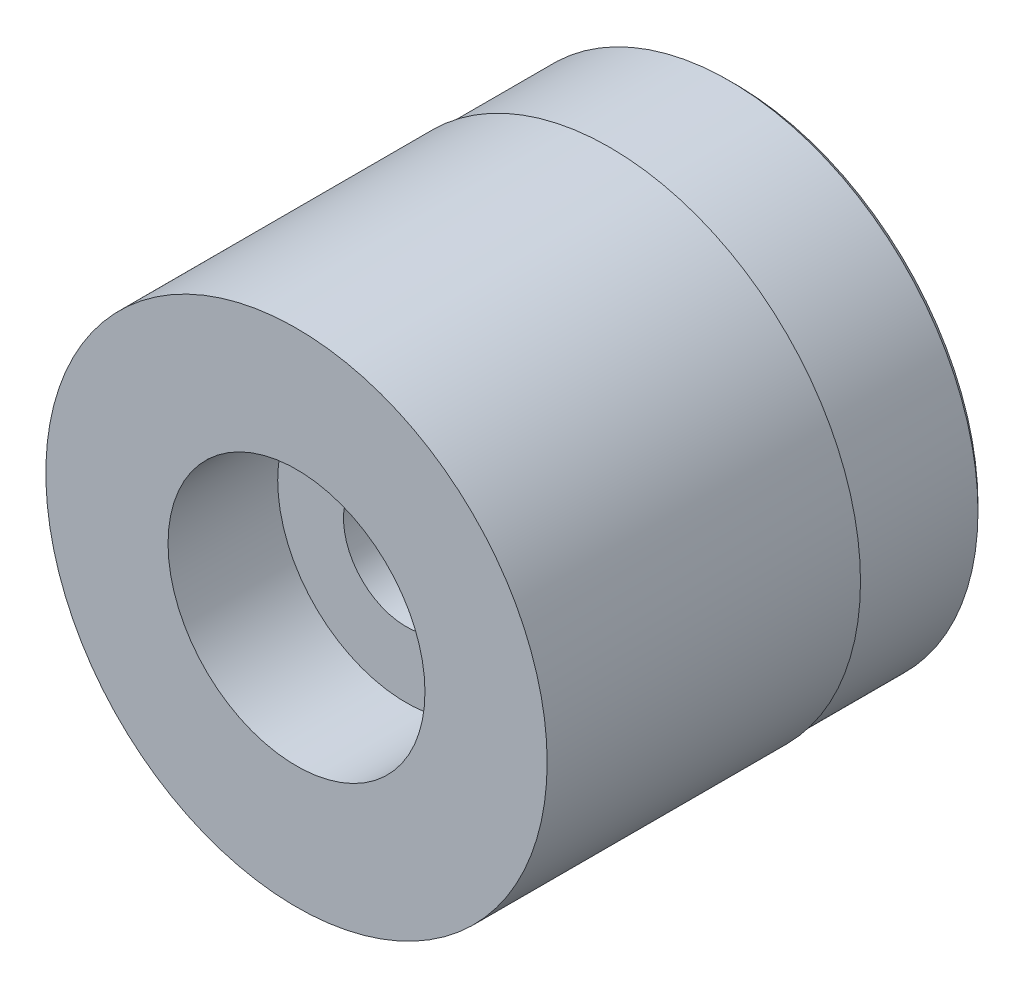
SolidWorks part; units mm, degrees
ref_plane "Front Plane" through (0, 0, 0) normal (0, 0, 1) x (1, 0, 0)
ref_plane "Top Plane" through (0, 0, 0) normal (0, 1, 0) x (1, 0, 0)
ref_plane "Right Plane" through (0, 0, 0) normal (1, 0, 0) x (0, 0, -1)
sketch "Sketch1" plane through (0, 0, 0) normal (1, 0, 0) x (0, 0, -1)
  line L2 (0, 8) -> (0, 4.1)
  line L3 (13.75, 8) -> (0, 8)
  line L4 (-3.7979, 0) -> (49996.2021, 0) construction
  line L8 (14, 2) -> (3.5, 2)
  line L9 (3.5, 4.1) -> (3.5, 2)
  line L10 (3.5, 4.1) -> (0, 4.1)
  line L12 (14, 2) -> (14, 7.75)
  line L16 (14, 7.75) -> (13.75, 8)
  dimension "D1" = 14
  dimension "D2" = 45
  dimension "D3" = 0.25
  dimension "D4" = 16
  dimension "D5" = 8.2
  dimension "D6" = 3.5
  dimension "D7" = 4
revolve "Revolve1" add sketch "Sketch1" angle 360 about L4
sketch "Sketch4" plane through (0, 0, 0) normal (1, 0, 0) x (0, 0, -1)
  line L0 (0, 0) -> (50000, 0) construction
  line L1 (14, -7.75) -> (14, 7.75) construction
  line L2 (10, 8.935) -> (14, 8.935)
  line L3 (10, 8.935) -> (10, 7.935)
  line L4 (10, 7.935) -> (14, 7.935)
  line L5 (14, 8.935) -> (14, 7.935)
  line L6 (13.75, 8) -> (0, 8) construction
  line L9 (0, 55) -> (0, -55) construction
  dimension "D1" = 1
  dimension "D2" = 0.065
  dimension "D3" = 10
revolve "Cut-Revolve1" cut sketch "Sketch4" angle 360 about L0
